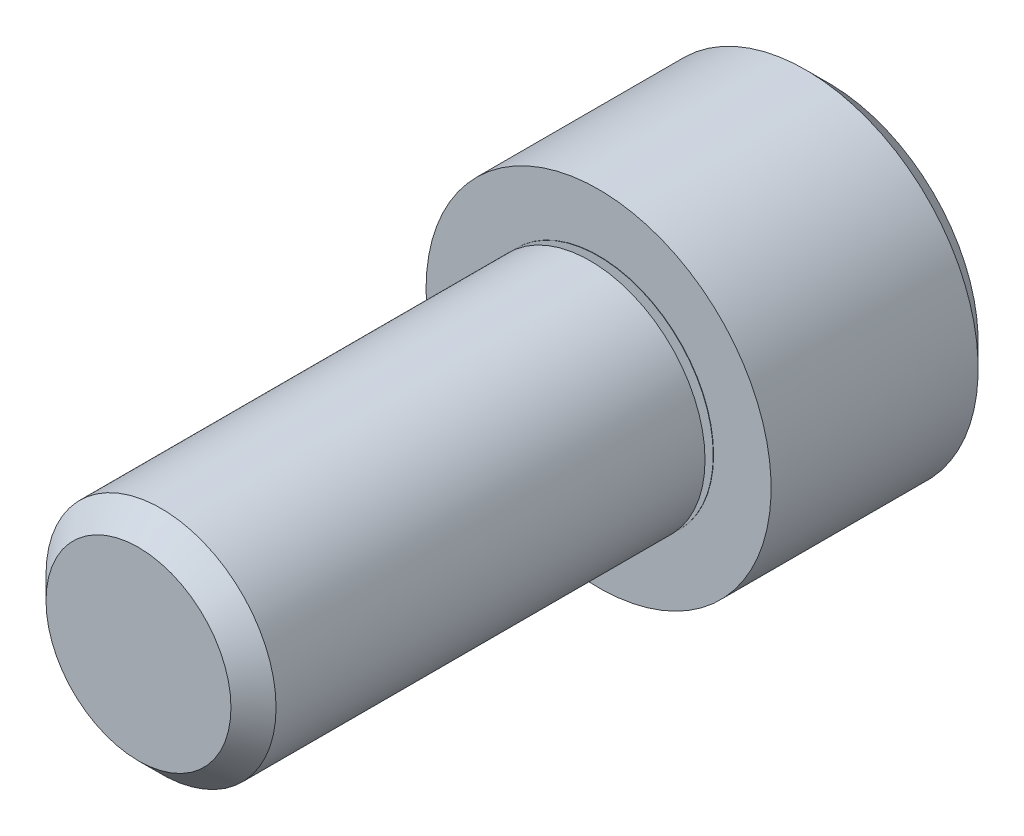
SolidWorks part; units mm, degrees
ref_plane "Front" through (0, 0, 0) normal (0, 0, 1) x (1, 0, 0)
ref_plane "Top" through (0, 0, 0) normal (0, 1, 0) x (1, 0, 0)
ref_plane "Right" through (0, 0, 0) normal (1, 0, 0) x (0, 0, -1)
sketch "Logo3_Revol_Axis" plane through (0, 0, 0) normal (0, 1, 0) x (1, 0, 0)
  line L0 (0, -43.5172) -> (0, 43.5172) construction
sketch "Logo3_bib1" plane through (0, 0, 0) normal (0, -1, 0) x (-1, 0, 0)
  line L0 (0, -12.7) -> (0, 6.35)
  line L1 (0, 6.35) -> (4.1275, 6.35)
  line L2 (4.7625, 5.715) -> (4.7625, 0)
  line L3 (4.7625, 0) -> (3.175, 0)
  line L4 (3.175, 0) -> (3.175, -0.01)
  line L5 (3.175, -12.0777) -> (2.5527, -12.7)
  line L6 (2.5527, -12.7) -> (0, -12.7)
  line L7 (3.175, -0.01) -> (2.6661, -0.01)
  line L8 (2.6593, -0.0488) -> (3.175, -0.2365)
  line L9 (3.175, -0.2365) -> (3.175, -12.0777)
  line L10 (0, 10.5852) -> (0, -63.2873) construction
  line L11 (4.1275, 6.35) -> (4.7625, 5.715)
  arc A1 (2.6661, -0.01) -> (2.6593, -0.0488) centre (2.6661, -0.03) ccw
  point P17 (2.5527, -0.01)
  point P19 (4.7625, 6.35)
revolve "Revolve1" add sketch "Logo3_bib1" angle 360 about L10
sketch "Logo3_bib2" plane through (0, 0, -6.35) normal (0, 0, -1) x (1, 0, 0)
  line L1 (2.7496, 0) -> (1.3748, 2.3813)
  line L2 (1.3748, 2.3813) -> (-1.3748, 2.3813)
  line L3 (-1.3748, 2.3813) -> (-2.7496, 0)
  line L4 (-2.7496, 0) -> (-1.3748, -2.3813)
  line L5 (-1.3748, -2.3813) -> (1.3748, -2.3813)
  line L6 (1.3748, -2.3813) -> (2.7496, 0)
  circle A0 centre (0, 0) radius 2.3812 construction
  dimension "Logo3_c1" = 4.7625
extrude "Cut-Extrude1" cut sketch "Logo3_bib2" against normal blind 3.175
equation "\"DIA2@Logo3_bib1\" = \"Logo3_d1-pas@Logo3_bib1\""
equation "\"LGT1@Logo3_bib1\" = \"Logo3_d1@Logo3_bib1\""
equation "\"D1@Cut-Extrude1\" = \"Logo3_d1@Logo3_bib1\"/2."
equation "\"D2@Cosmetic Thread1\" = \"Logo3_d1-pas@Logo3_bib1\""
equation "\"D5@Logo3_bib1\"=\"Logo3_d1@Logo3_bib1\"*.1"
